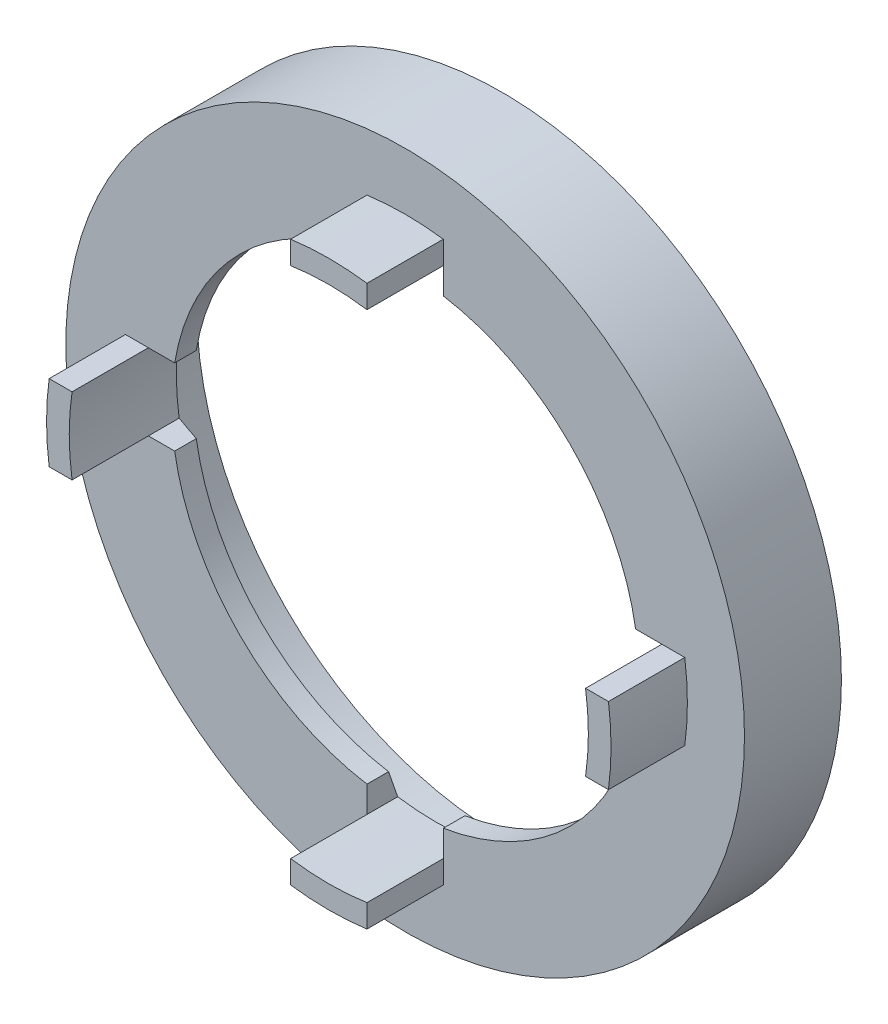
SolidWorks part; units mm, degrees
ref_plane "Front Plane" through (0, 0, 0) normal (0, 0, 1) x (1, 0, 0)
ref_plane "Top Plane" through (0, 0, 0) normal (0, 1, 0) x (1, 0, 0)
ref_plane "Right Plane" through (0, 0, 0) normal (1, 0, 0) x (0, 0, -1)
ref_plane "Plane1" through (0, 0, 1.8) normal (0, 0, 1) x (1, 0, 0)
ref_plane "Plane2" through (0, 0, 3.24) normal (0, 0, 1) x (1, 0, 0)
sketch "Sketch1" plane through (0, 0, 0) normal (0, 0, 1) x (1, 0, 0)
  circle A0 centre (0, 0) radius 22.225
  dimension "D1" = 44.45
extrude "Boss-Extrude1" add sketch "Sketch1" along normal blind 6.35
sketch "Sketch2" plane through (0, 0, 6.35) normal (0, 0, 1) x (1, 0, 0)
  circle A0 centre (0, 0) radius 15.3
  dimension "D1" = 30.6
extrude "Cut-Extrude1" cut sketch "Sketch2" against normal up to next
sketch "Sketch3" plane through (0, 0, 0) normal (0, 1, 0) x (1, 0, 0)
  line L0 (0, 1.4244) -> (0, 7.804) construction
  line L1 (0, 0) -> (-20, 0) construction
  line L2 (-20, 0) -> (-15, 0)
  line L3 (0, -5.0414) -> (-15, -5.0414) construction
  line L4 (-20, 0) -> (-20, -4.3386)
  line L5 (-17, -4.3386) -> (-15, -5.0414)
  line L6 (-15, -5.0414) -> (-15, 0)
  line L8 (-22.225, -6.35) -> (22.225, -6.35) construction
  line L15 (-17, -4.3386) -> (-20, -4.3386)
  point P9 (-16, -4.69)
  dimension "D1" = 15
  dimension "D2" = 20
  dimension "D3" = 70.639
  dimension "D4" = 16
  dimension "D5" = 1.66
  dimension "D8" = 17
revolve "Cut-Revolve1" cut sketch "Sketch3" angle 360 about L0
sketch "Sketch5" plane through (0, 0, 0) normal (0, 1, 0) x (1, 0, 0)
  line L0 (0, 0) -> (0, -50000) construction
  line L1 (22.225, 0) -> (-22.225, 0) construction
  line L2 (0, -6.35) -> (-17.5, -6.35) construction
  line L3 (-22.225, -6.35) -> (22.225, -6.35) construction
  line L4 (0, -6.506) -> (-12.6866, -6.506) construction
  line L5 (-17.5, -6.35) -> (-17.5, 0) construction
  line L6 (-12.6866, -6.506) -> (-12.6866, -6.35)
  line L7 (-12.6866, -6.35) -> (-17.5, -6.35)
  line L8 (-17.5, -6.35) -> (-17.5, -4.12)
  line L9 (-17.5, -4.12) -> (-18.9494, -4.12)
  line L10 (-12.6866, -6.506) -> (-12.6866, -4.936) construction
  line L11 (-15.3, -4.936) -> (15.3, -4.936) construction
  line L12 (20, 0) -> (-20, 0) construction
  arc A0 (-12.6866, -6.506) -> (-18.9494, -4.12) centre (-12, 4.7085) cw
  point P4 (0, 0)
  point P21 (-16, -5.7908)
  point P22 (16, -5.7908)
  dimension "D1" = 17.5
  dimension "D2" = 11.2355
  dimension "D3" = 12
  dimension "D4" = 1.57
  dimension "D5" = 16
  dimension "D6" = 2.23
revolve "Cut-Revolve2" [suppressed] cut sketch "Sketch5" angle 360 about L0
sketch "Sketch7" plane through (0, 0, 6.35) normal (0, 0, 1) x (1, 0, 0)
  line L0 (0, 0) -> (-50000, 0) construction
  line L1 (-16.8152, 2.5) -> (-18.3152, 2.5)
  line L2 (-18.3152, -2.5) -> (-16.8152, -2.5)
  arc A0 (-16.8152, 2.5) -> (-16.8152, -2.5) centre (0, 0) ccw
  arc A1 (-18.3152, 2.5) -> (-18.3152, -2.5) centre (0, 0) ccw
  dimension "D1" = 17
  dimension "D3" = 1.5
  dimension "D2" = 5
extrude "Boss-Extrude2" add sketch "Sketch7" along normal blind 5
sketch "Sketch8" plane through (0, 0, 6.35) normal (0, 0, 1) x (1, 0, 0)
  line L0 (-16.8152, 2.5) -> (-15.0944, 2.5)
  line L1 (-16.8152, -2.5) -> (-15.0944, -2.5)
  line L2 (-15.0944, -2.5) -> (-15.0944, 2.5)
  arc A0 (-16.8152, 2.5) -> (-16.8152, -2.5) centre (0, 0) ccw
  circle A1 centre (0, 0) radius 15.3 construction
extrude "Cut-Extrude2" cut sketch "Sketch8" against normal through all
pattern_circular "CirPattern1" count 4 over 360 about axis through (0, 0, 0) along (0, 0, 1) of "Boss-Extrude2", "Cut-Extrude2"
